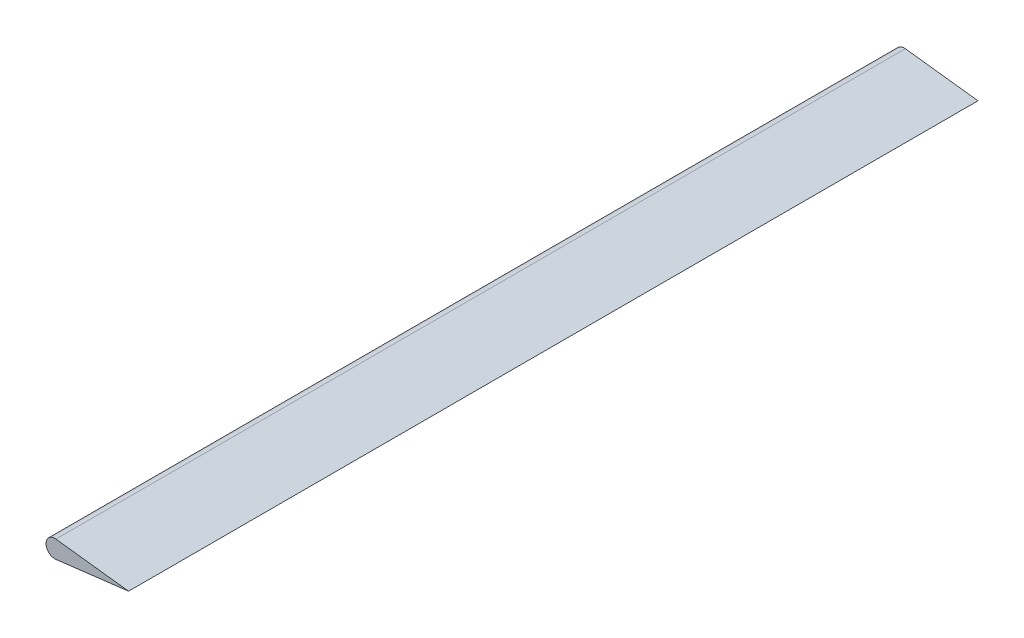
SolidWorks part; units mm, degrees
ref_plane "XY" through (0, 0, 0) normal (0, 0, 1) x (1, 0, 0)
ref_plane "XZ" through (0, 0, 0) normal (0, 1, 0) x (1, 0, 0)
ref_plane "YZ" through (0, 0, 0) normal (1, 0, 0) x (0, 0, -1)
sketch "Sketch1" plane through (0, 0, 0) normal (0, 0, 1) x (1, 0, 0)
  line L0 (2.286, 18.9123) -> (158.75, 0)
  line L1 (2.286, -18.9123) -> (158.75, 0)
  line L2 (50, 0) -> (-50, 0) construction
  arc A0 (2.286, 18.9123) -> (2.286, -18.9123) centre (0, 0) ccw
  dimension "D1" = 158.75
  dimension "D2" = 19.05
extrude "Base-Extrude" add sketch "Sketch1" along normal blind 1828.8
